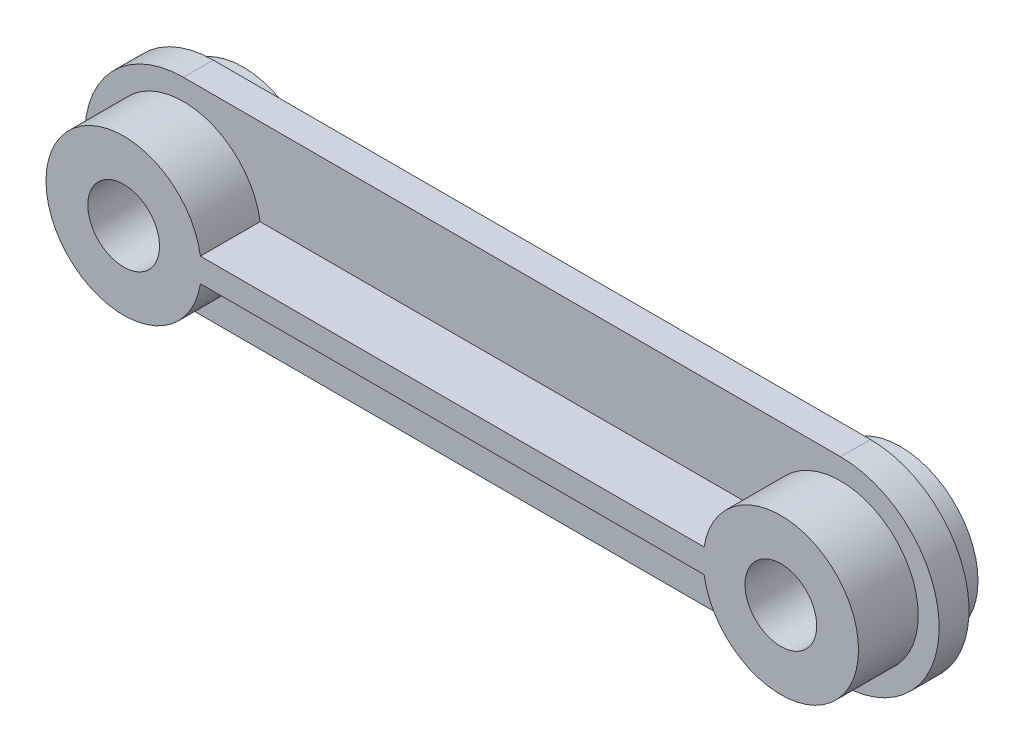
SolidWorks part; units mm, degrees
ref_plane "前视基准面" through (0, 0, 0) normal (0, 0, 1) x (1, 0, 0)
ref_plane "上视基准面" through (0, 0, 0) normal (0, 1, 0) x (1, 0, 0)
ref_plane "右视基准面" through (0, 0, 0) normal (1, 0, 0) x (0, 0, -1)
sketch "草图1" plane through (0, 0, 0) normal (0, 0, 1) x (1, 0, 0)
  line L0 (-84.9045, 0) -> (80.356, 0) construction
  line L1 (-110, 33) -> (110, 33)
  line L2 (-110, -33) -> (110, -33)
  arc A0 (-110, 33) -> (-110, -33) centre (-110, 0) ccw
  arc A1 (110, -33) -> (110, 33) centre (110, 0) ccw
  dimension "D1" = 66
  dimension "D2" = 66
  dimension "D3" = 220
  dimension "D4" = 110
extrude "拉伸1" add sketch "草图1" along normal blind 10
sketch "草图2" plane through (0, 0, 10) normal (0, 0, 1) x (1, 0, 0)
  line L0 (-84.3095, 4) -> (84.3095, 4)
  line L1 (-84.3095, -4) -> (84.3095, -4)
  arc A0 (-84.3095, 4) -> (-84.3095, -4) centre (-110, 0) ccw
  arc A1 (84.3095, -4) -> (84.3095, 4) centre (110, 0) ccw
  dimension "D1" = 52
  dimension "D2" = 52
  dimension "D3" = 8
  dimension "D4" = 4
extrude "拉伸2" add sketch "草图2" along normal blind 20
sketch "草图3" plane through (0, 0, 0) normal (0, 0, -1) x (-1, 0, 0)
  circle A0 centre (-110, 0) radius 26
  circle A1 centre (110, 0) radius 26
  dimension "D1" = 52
  dimension "D2" = 52
extrude "拉伸3" add sketch "草图3" along normal blind 10
sketch "草图4" plane through (0, 0, -10) normal (0, 0, -1) x (-1, 0, 0)
  circle A0 centre (-110, 0) radius 12
  circle A1 centre (110, 0) radius 12
  dimension "D1" = 24
  dimension "D2" = 24
extrude "切除-拉伸1" cut sketch "草图4" against normal through all
